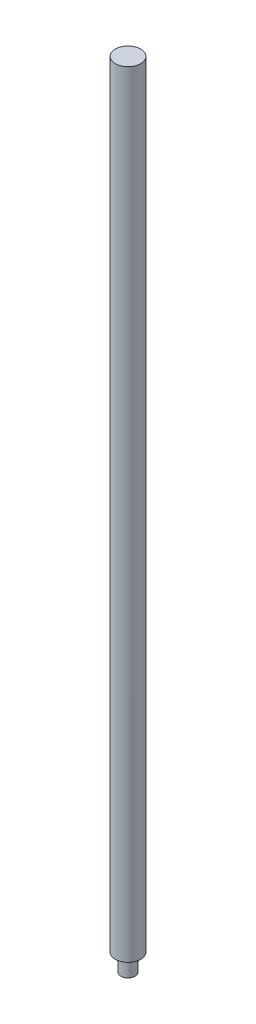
SolidWorks part; units mm, degrees
ref_plane "前视基准面" through (0, 0, 0) normal (0, 0, 1) x (1, 0, 0)
ref_plane "上视基准面" through (0, 0, 0) normal (0, 1, 0) x (1, 0, 0)
ref_plane "右视基准面" through (0, 0, 0) normal (1, 0, 0) x (0, 0, -1)
other "Configuration Table"
sketch "草图1" plane through (0, 0, 0) normal (0, 1, 0) x (1, 0, 0)
  circle A0 centre (0, 0) radius 8
  dimension "D1" = 16
extrude "凸台-拉伸1" add sketch "草图1" along normal blind 500
sketch "草图2" plane through (0, 0, 0) normal (0, -1, 0) x (1, 0, 0)
  circle A0 centre (0, 0) radius 4.5
  dimension "D1" = 9
extrude "切除-拉伸1" cut sketch "草图2" against normal blind 11 flip side to cut
